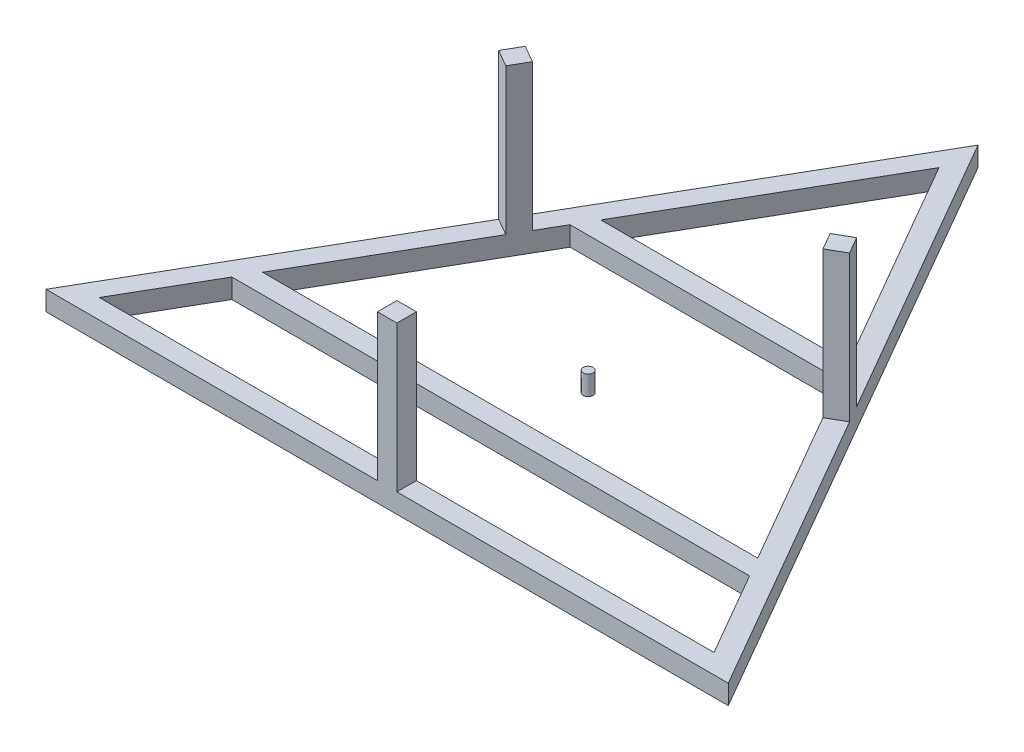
SolidWorks part; units mm, degrees
ref_plane "前视基准面" through (0, 0, 0) normal (0, 0, 1) x (1, 0, 0)
ref_plane "上视基准面" through (0, 0, 0) normal (0, 1, 0) x (1, 0, 0)
ref_plane "右视基准面" through (0, 0, 0) normal (1, 0, 0) x (0, 0, -1)
sketch "草图1" plane through (0, 0, 0) normal (0, 1, 0) x (1, 0, 0)
  line L0 (-350, -206.2178) -> (350, -206.2178)
  line L13 (350, -206.2178) -> (0, 400)
  line L14 (0, 400) -> (-350, -206.2178)
  line L15 (315.359, -186.2178) -> (265.5811, -100)
  line L16 (0, 360) -> (-127.0171, 140)
  line L17 (-315.359, -186.2178) -> (315.359, -186.2178)
  line L18 (127.0171, 140) -> (0, 360)
  line L19 (-254.0341, -80) -> (254.0341, -80)
  line L20 (-265.5811, -100) -> (265.5811, -100)
  line L21 (-127.0171, 140) -> (127.0171, 140)
  line L22 (-138.5641, 120) -> (138.5641, 120)
  line L23 (315.359, -186.2178) -> (0, 360) construction
  line L24 (-138.5641, 120) -> (-254.0341, -80)
  line L25 (0, 360) -> (-315.359, -186.2178) construction
  line L26 (-265.5811, -100) -> (-315.359, -186.2178)
  line L27 (254.0341, -80) -> (138.5641, 120)
  dimension "D2" = 700
  dimension "D1" = 20
  dimension "D3" = 360
  dimension "D4" = 20
  dimension "D5" = 120
  dimension "D6" = 80
  dimension "D7" = 20
extrude "凸台-拉伸1" add sketch "草图1" along normal blind 20
sketch "草图2" plane through (0, 20, 0) normal (0, 1, 0) x (1, 0, 0)
  line L0 (-455.0328, 258.5681) -> (-62.6695, 32.037) construction
  line L1 (-152.6795, 95.5514) -> (-170, 105.5514)
  line L2 (-138.5641, 120) -> (-254.0341, -80) construction
  line L3 (0, 400) -> (-350, -206.2178) construction
  line L4 (-162.6795, 78.2309) -> (-180, 88.2309)
  line L11 (-152.6795, 95.5514) -> (-162.6795, 78.2309)
  line L12 (-170, 105.5514) -> (-180, 88.2309)
  line L15 (98.3714, 52.6496) -> (361.7052, 204.6854) construction
  line L16 (350, -206.2178) -> (0, 400) construction
  line L17 (170, 105.5514) -> (152.6795, 95.5514)
  line L18 (254.0341, -80) -> (138.5641, 120) construction
  line L19 (180, 88.2309) -> (162.6795, 78.2309)
  line L20 (170, 105.5514) -> (180, 88.2309)
  line L21 (152.6795, 95.5514) -> (162.6795, 78.2309)
  line L22 (0, 0) -> (0, -206.2178) construction
  line L23 (-350, -206.2178) -> (350, -206.2178) construction
  line L24 (-10, -186.2178) -> (-10, -206.2178)
  line L25 (-315.359, -186.2178) -> (315.359, -186.2178) construction
  line L26 (10, -186.2178) -> (10, -206.2178)
  line L27 (-10, -186.2178) -> (10, -186.2178)
  line L28 (10, -206.2178) -> (-10, -206.2178)
  point P23 (0, 0)
  dimension "D1" = 20
  dimension "D3" = 350
  dimension "D2" = 20
  dimension "D4" = 350
  dimension "D5" = 20
  dimension "D6" = 20
extrude "凸台-拉伸2" add sketch "草图2" along normal blind 150
sketch "草图3" plane through (0, 20, 0) normal (0, 1, 0) x (1, 0, 0)
  circle A0 centre (0, 0) radius 5
  dimension "D1" = 10
extrude "凸台-拉伸3" add sketch "草图3" against normal blind 20 separate body
